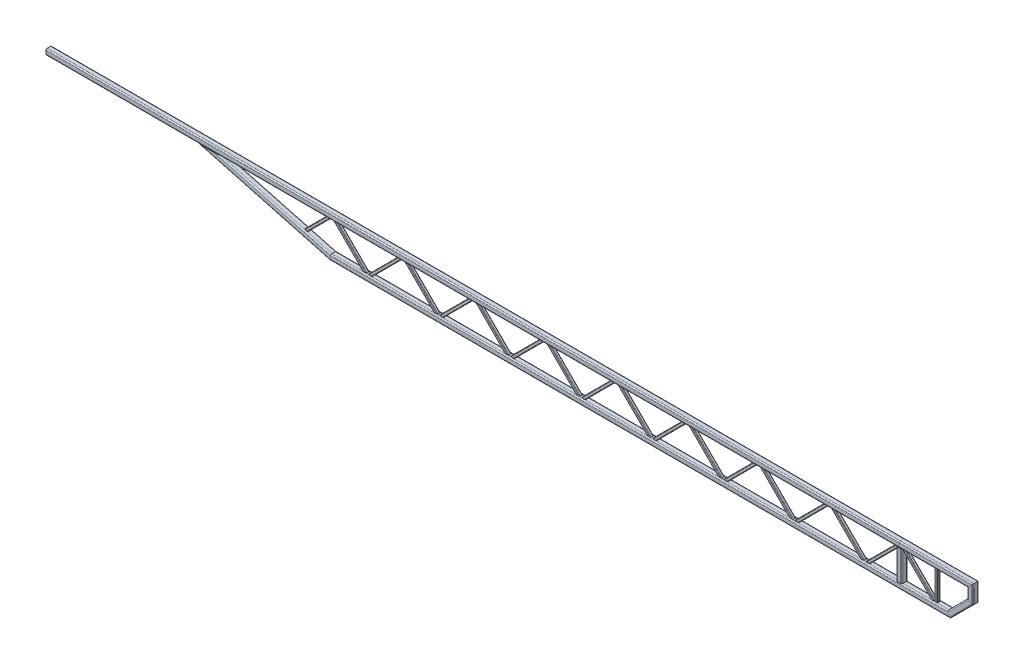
SolidWorks part; units mm, degrees
ref_plane "Plan de face" through (0, 0, 0) normal (0, 0, 1) x (1, 0, 0)
ref_plane "Plan de dessus" through (0, 0, 0) normal (0, 1, 0) x (1, 0, 0)
ref_plane "Plan de droite" through (0, 0, 0) normal (1, 0, 0) x (0, 0, -1)
sketch "Esquisse2" plane through (0, 0, 0) normal (0, 0, 1) x (1, 0, 0)
  line L0 (-4000, 250) -> (2000, 250)
  line L1 (2000, 250) -> (2000, 0)
  line L2 (-2000, 0) -> (2350, 0)
  line L3 (-2000, 0) -> (-2933.0127, 250)
  line L4 (-2000, 250) -> (-2197.1688, 52.8312)
  line L5 (2350, 0) -> (2500, 150)
  line L6 (2500, 150) -> (2500, 250)
  line L7 (2500, 250) -> (2000, 250)
  line L8 (-4000, 250) -> (2500, 250)
  line L9 (-2000, 250) -> (-1750, 0)
  line L10 (-2000, 0) -> (-2933.0127, 250)
  line L11 (2000, 0) -> (2000, 250)
  line L12 (2500, 250) -> (2500, 150)
  line L13 (2500, 150) -> (2350, 0)
  line L14 (-1750, 0) -> (-1500, 250)
  line L15 (-1500, 250) -> (-1250, 0)
  line L16 (-1250, 0) -> (-1000, 250)
  line L17 (-1000, 250) -> (-750, 0)
  line L18 (-750, 0) -> (-500, 250)
  line L19 (-500, 250) -> (-250, 0)
  line L20 (-250, 0) -> (0, 250)
  line L21 (0, 250) -> (250, 0)
  line L22 (250, 0) -> (500, 250)
  line L23 (500, 250) -> (750, 0)
  line L24 (750, 0) -> (1000, 250)
  line L25 (1000, 250) -> (1250, 0)
  line L26 (1250, 0) -> (1500, 250)
  line L27 (1500, 250) -> (1750, 0)
  line L28 (1750, 0) -> (2000, 250)
  line L29 (2000, 250) -> (2250, 0)
  line L30 (2250, 0) -> (2250, 250)
  dimension "D1" = 6500
  dimension "D2" = 500
  dimension "D3" = 4350
  dimension "D4" = 2000
  dimension "D5" = 100
  dimension "D6" = 135
  dimension "D7" = 15
  dimension "D8" = 350
  dimension "D9" = 250
  dimension "D10" = 278.8388
other "Elément mécano-soudé1"
ref_plane "Plan1" through (-4000, 250, 0) normal (1, 0, 0) x (0, 1, 0)
sketch "Sketch1" plane through (-4000, 250, 0) normal (1, 0, 0) x (0, 1, 0)
  line L0 (-12, -16) -> (12, -16)
  line L1 (-16, -12) -> (-16, 12)
  line L2 (12, 16) -> (-12, 16)
  line L3 (16, 12) -> (16, -12)
  line L4 (-12, -20) -> (12, -20)
  line L5 (-20, -12) -> (-20, 12)
  line L6 (12, 20) -> (-12, 20)
  line L7 (20, 12) -> (20, -12)
  arc A0 (20, 12) -> (12, 20) centre (12, 12) ccw
  arc A1 (12, -20) -> (20, -12) centre (12, -12) ccw
  arc A2 (-20, -12) -> (-12, -20) centre (-12, -12) ccw
  arc A3 (-12, 20) -> (-20, 12) centre (-12, 12) ccw
  arc A4 (-12, 16) -> (-16, 12) centre (-12, 12) ccw
  arc A5 (16, 12) -> (12, 16) centre (12, 12) ccw
  arc A6 (12, -16) -> (16, -12) centre (12, -12) ccw
  arc A7 (-16, -12) -> (-12, -16) centre (-12, -12) ccw
  point P0 (-20, 0)
  point P1 (20, 0)
  point P2 (0, 20)
  point P3 (0, -20)
  point P4 (0, 0)
  point P5 (-20, -20)
  point P6 (20, -20)
  point P7 (20, 20)
  point P8 (-20, 20)
  point P33 (0, 0)
  dimension "D1" = 8
  dimension "Thickness" = 4
  dimension "V_leg" = 40
other "Elément mécano-soudé2"
ref_plane "Plan2" through (-2000, 0, 0) normal (-0.9659, 0.2588, 0) x (-0.2588, -0.9659, 0)
sketch "Sketch11" plane through (-2000, 0, 0) normal (-0.9659, 0.2588, 0) x (-0.2588, -0.9659, 0)
  line L0 (-12, -16) -> (12, -16)
  line L1 (-16, -12) -> (-16, 12)
  line L2 (12, 16) -> (-12, 16)
  line L3 (16, 12) -> (16, -12)
  line L4 (-12, -20) -> (12, -20)
  line L5 (-20, -12) -> (-20, 12)
  line L6 (12, 20) -> (-12, 20)
  line L7 (20, 12) -> (20, -12)
  arc A0 (20, 12) -> (12, 20) centre (12, 12) ccw
  arc A1 (12, -20) -> (20, -12) centre (12, -12) ccw
  arc A2 (-20, -12) -> (-12, -20) centre (-12, -12) ccw
  arc A3 (-12, 20) -> (-20, 12) centre (-12, 12) ccw
  arc A4 (-12, 16) -> (-16, 12) centre (-12, 12) ccw
  arc A5 (16, 12) -> (12, 16) centre (12, 12) ccw
  arc A6 (12, -16) -> (16, -12) centre (12, -12) ccw
  arc A7 (-16, -12) -> (-12, -16) centre (-12, -12) ccw
  point P0 (-20, 0)
  point P1 (20, 0)
  point P2 (0, 20)
  point P3 (0, -20)
  point P4 (0, 0)
  point P5 (-20, -20)
  point P6 (20, -20)
  point P7 (20, 20)
  point P8 (-20, 20)
  point P33 (0, 0)
  dimension "D1" = 8
  dimension "Thickness" = 4
  dimension "V_leg" = 40
other "Ajuster/Prolonger1"
other "Elément mécano-soudé3"
ref_plane "Plan3" through (2000, 250, 0) normal (0, -1, 0) x (1, 0, 0)
sketch "Sketch12" plane through (2000, 250, 0) normal (0, -1, 0) x (1, 0, 0)
  line L0 (-12, -16) -> (12, -16)
  line L1 (-16, -12) -> (-16, 12)
  line L2 (12, 16) -> (-12, 16)
  line L3 (16, 12) -> (16, -12)
  line L4 (-12, -20) -> (12, -20)
  line L5 (-20, -12) -> (-20, 12)
  line L6 (12, 20) -> (-12, 20)
  line L7 (20, 12) -> (20, -12)
  arc A0 (20, 12) -> (12, 20) centre (12, 12) ccw
  arc A1 (12, -20) -> (20, -12) centre (12, -12) ccw
  arc A2 (-20, -12) -> (-12, -20) centre (-12, -12) ccw
  arc A3 (-12, 20) -> (-20, 12) centre (-12, 12) ccw
  arc A4 (-12, 16) -> (-16, 12) centre (-12, 12) ccw
  arc A5 (16, 12) -> (12, 16) centre (12, 12) ccw
  arc A6 (12, -16) -> (16, -12) centre (12, -12) ccw
  arc A7 (-16, -12) -> (-12, -16) centre (-12, -12) ccw
  point P0 (-20, 0)
  point P1 (20, 0)
  point P2 (0, 20)
  point P3 (0, -20)
  point P4 (0, 0)
  point P5 (-20, -20)
  point P6 (20, -20)
  point P7 (20, 20)
  point P8 (-20, 20)
  point P33 (0, 0)
  dimension "D1" = 8
  dimension "Thickness" = 4
  dimension "V_leg" = 40
other "Ajuster/Prolonger2"
other "Ajuster/Prolonger3"
other "Ajuster/Prolonger4"
other "Ajuster/Prolonger5"
other "Elément mécano-soudé4"
ref_plane "Plan4" through (-2000, 250, 0) normal (-0.7071, -0.7071, 0) x (0, 0, 1)
sketch "Sketch14" plane through (-2000, 250, 0) normal (-0.7071, -0.7071, 0) x (0, 0, 1)
  line L0 (-6, -8) -> (6, -8)
  line L1 (-8, -6) -> (-8, 6)
  line L2 (6, 8) -> (-6, 8)
  line L3 (8, 6) -> (8, -6)
  line L4 (-6, -10) -> (6, -10)
  line L5 (-10, -6) -> (-10, 6)
  line L6 (6, 10) -> (-6, 10)
  line L7 (10, 6) -> (10, -6)
  arc A0 (10, 6) -> (6, 10) centre (6, 6) ccw
  arc A1 (6, -10) -> (10, -6) centre (6, -6) ccw
  arc A2 (-10, -6) -> (-6, -10) centre (-6, -6) ccw
  arc A3 (-6, 10) -> (-10, 6) centre (-6, 6) ccw
  arc A4 (-6, 8) -> (-8, 6) centre (-6, 6) ccw
  arc A5 (8, 6) -> (6, 8) centre (6, 6) ccw
  arc A6 (6, -8) -> (8, -6) centre (6, -6) ccw
  arc A7 (-8, -6) -> (-6, -8) centre (-6, -6) ccw
  point P0 (-10, 0)
  point P1 (10, 0)
  point P2 (0, 10)
  point P3 (0, -10)
  point P4 (0, 0)
  point P5 (-10, -10)
  point P6 (10, -10)
  point P7 (10, 10)
  point P8 (-10, 10)
  point P33 (0, 0)
  dimension "D1" = 4
  dimension "Thickness" = 2
  dimension "V_leg" = 20
other "Ajuster/Prolonger6"
other "Ajuster/Prolonger7"
other "Ajuster/Prolonger8"
other "Ajuster/Prolonger9"
other "Ajuster/Prolonger10"
other "Ajuster/Prolonger11"
other "Ajuster/Prolonger12"
other "Ajuster/Prolonger13"
other "Ajuster/Prolonger20"
other "Ajuster/Prolonger21"
delete or keep bodies "Corps-Effacer/suppr1" type delete bodies bodies 229
delete or keep bodies "Corps-Effacer/suppr2" type delete bodies bodies 140
delete or keep bodies "Corps-Effacer/suppr3" type delete bodies bodies 142
delete or keep bodies "Corps-Effacer/suppr4" type delete bodies bodies 145
delete or keep bodies "Corps-Effacer/suppr5" type delete bodies bodies 148
delete or keep bodies "Corps-Effacer/suppr6" type delete bodies bodies 181
delete or keep bodies "Corps-Effacer/suppr7" type delete bodies bodies 183
delete or keep bodies "Corps-Effacer/suppr8" type delete bodies bodies 186
delete or keep bodies "Corps-Effacer/suppr9" type delete bodies bodies 184
delete or keep bodies "Corps-Effacer/suppr10" type delete bodies bodies 187
delete or keep bodies "Corps-Effacer/suppr11" type delete bodies bodies 196
delete or keep bodies "Corps-Effacer/suppr12" type delete bodies bodies 192
delete or keep bodies "Corps-Effacer/suppr13" type delete bodies bodies 190
delete or keep bodies "Corps-Effacer/suppr14" type delete bodies bodies 189
delete or keep bodies "Corps-Effacer/suppr15" type delete bodies bodies 193
delete or keep bodies "Corps-Effacer/suppr16" type delete bodies bodies 195
delete or keep bodies "Corps-Effacer/suppr17" type delete bodies bodies 198
delete or keep bodies "Corps-Effacer/suppr18" type delete bodies bodies 199
delete or keep bodies "Corps-Effacer/suppr19" type delete bodies bodies 201
delete or keep bodies "Corps-Effacer/suppr20" type delete bodies bodies 202
delete or keep bodies "Corps-Effacer/suppr21" type delete bodies bodies 205
delete or keep bodies "Corps-Effacer/suppr22" type delete bodies bodies 204
delete or keep bodies "Corps-Effacer/suppr23" type delete bodies bodies 207
delete or keep bodies "Corps-Effacer/suppr24" type delete bodies bodies 208
delete or keep bodies "Corps-Effacer/suppr25" type delete bodies bodies 216
delete or keep bodies "Corps-Effacer/suppr26" type delete bodies bodies 210
delete or keep bodies "Corps-Effacer/suppr27" type delete bodies bodies 219
delete or keep bodies "Corps-Effacer/suppr28" type delete bodies bodies 217
delete or keep bodies "Corps-Effacer/suppr29" type delete bodies bodies 223
delete or keep bodies "Corps-Effacer/suppr30" type delete bodies bodies 222
delete or keep bodies "Corps-Effacer/suppr31" type delete bodies bodies 211
delete or keep bodies "Corps-Effacer/suppr32" type delete bodies bodies 225
delete or keep bodies "Corps-Effacer/suppr33" type delete bodies bodies 213
delete or keep bodies "Corps-Effacer/suppr34" type delete bodies bodies 214
delete or keep bodies "Corps-Effacer/suppr35" type delete bodies bodies 226
delete or keep bodies "Corps-Effacer/suppr36" type delete bodies bodies 220
sketch "Esquisse3" plane through (0, 0, 20) normal (0, 0, 1) x (1, 0, 0)
  line L0 (-363.1832, 146.8302) -> (-363.1832, -12)
  line L1 (2354.9706, -12) -> (-2001.5798, -12) construction
  line L2 (-363.1832, -12) -> (0, 0)
  point P0 (0, 0)
  point P1 (0, 0)
  point P3 (-363.1832, 146.8302)
  point P8 (1999.9946, 146.8302)
  dimension "D1" = 363.1832
  dimension "D2" = 158.8302
  dimension "D3" = 2363.1778
